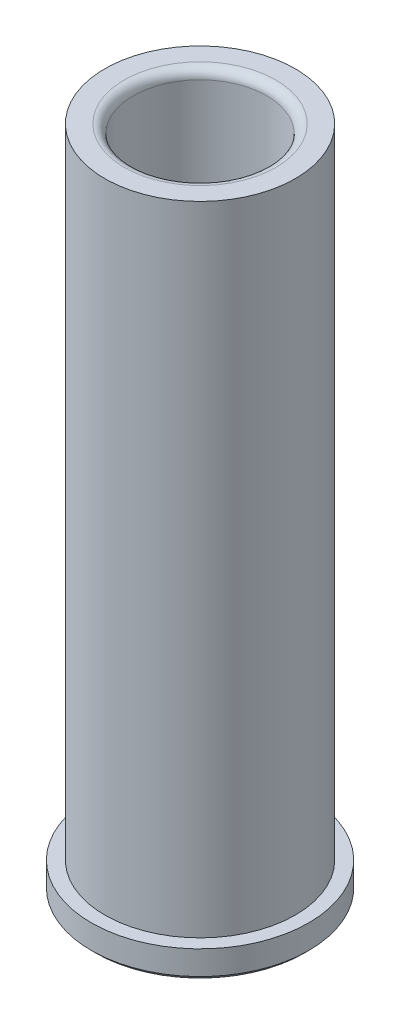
SolidWorks part; units mm, degrees
ref_plane "Front Plane" through (0, 0, 0) normal (0, 0, 1) x (1, 0, 0)
ref_plane "Top Plane" through (0, 0, 0) normal (0, 1, 0) x (1, 0, 0)
ref_plane "Right Plane" through (0, 0, 0) normal (1, 0, 0) x (0, 0, -1)
sketch "Sketch1" plane through (0, 0, 0) normal (0, 0, 1) x (1, 0, 0)
  line L0 (-17.3609, 0) -> (-18.1229, 0.762)
  line L1 (0, -1000) -> (0, 49000) construction
  line L2 (-11.1189, 111.125) -> (-11.1188, 0.762)
  line L3 (-11.8808, 0) -> (-17.3609, 0)
  line L4 (-18.1229, 0.762) -> (-18.1229, 4.7625)
  line L5 (-18.1229, 4.7625) -> (-15.8813, 4.7625)
  line L6 (-15.8813, 111.125) -> (-15.8813, 4.7625)
  line L7 (-15.8813, 111.125) -> (-11.1189, 111.125)
  line L8 (-11.8808, 0) -> (-11.1188, 0.762)
  dimension "OD" = 31.7627
  dimension "ID" = 22.2377
  dimension "H" = 36.2458
  dimension "D2" = 45
  dimension "OVERALL LENGTH" = 111.125
  dimension "D4" = 0.762
  dimension "D5" = 135
  dimension "T" = 4.7625
revolve "Revolve1" add sketch "Sketch1" angle 360 about L1
fillet "Fillet1" radius 1.524 1 edges at (11.1188, 111.125, 0)
